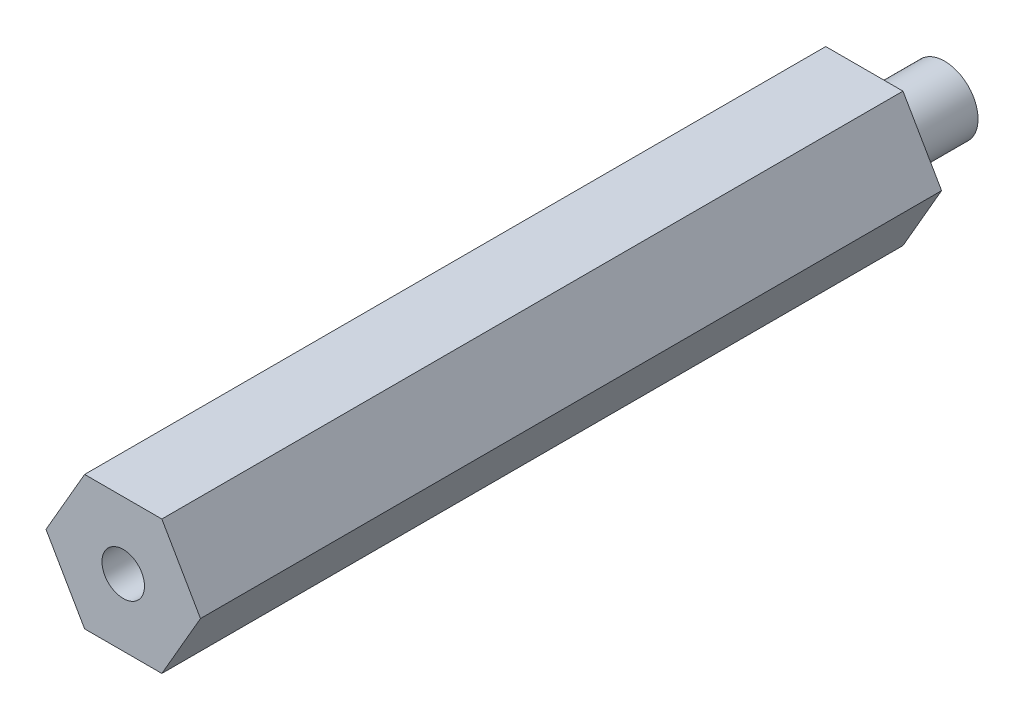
SolidWorks part; units mm, degrees
ref_plane "Front Plane" through (0, 0, 0) normal (0, 0, 1) x (1, 0, 0)
ref_plane "Top Plane" through (0, 0, 0) normal (0, 1, 0) x (1, 0, 0)
ref_plane "Right Plane" through (0, 0, 0) normal (1, 0, 0) x (0, 0, -1)
sketch "Sketch1" plane through (0, 0, 0) normal (0, 0, 1) x (1, 0, 0)
  line L1 (7.3323, 0) -> (3.6662, 6.35)
  line L2 (3.6662, 6.35) -> (-3.6662, 6.35)
  line L3 (-3.6662, 6.35) -> (-7.3323, 0)
  line L4 (-7.3323, 0) -> (-3.6662, -6.35)
  line L5 (-3.6662, -6.35) -> (3.6662, -6.35)
  line L6 (3.6662, -6.35) -> (7.3323, 0)
  circle A0 centre (0, 0) radius 6.35 construction
  dimension "D1" = 12.7
extrude "Boss-Extrude1" add sketch "Sketch1" along normal blind 77.978
sketch "Sketch2" plane through (0, 0, 0) normal (0, 1, 0) x (1, 0, 0)
  line L0 (3.6662, 0) -> (-3.6662, 0) construction
  line L1 (3.175, 0) -> (7.3323, 0)
  line L2 (3.175, 0) -> (3.175, -7.62)
  line L3 (3.175, -7.62) -> (7.3323, -7.62)
  line L4 (7.3323, 0) -> (7.3323, -7.62)
  line L5 (7.3323, -77.978) -> (7.3323, 0) construction
  line L6 (0, 0) -> (0, -77.978) construction
  line L7 (3.6662, -77.978) -> (-3.6662, -77.978) construction
  dimension "D1" = 6.35
  dimension "D3" = 7.62
revolve "Cut-Revolve1" cut sketch "Sketch2" angle 360 about L6
sketch "Sketch3" plane through (0, 0, 77.978) normal (0, 0, 1) x (1, 0, 0)
  line L0 (3.6662, 6.35) -> (-3.6662, -6.35) construction
  line L1 (7.3323, 0) -> (-7.3323, 0) construction
  point P8 (0, 0)
hole_wizard "#10-32 Tapped Hole1" positions "3DSketch2" profile "Sketch5" tap size "#10-32" standard "ANSI Inch"
sketch3d "3DSketch2"
  point P0 (0, 0, 77.978)
sketch "Sketch5" plane through (0, 0, 77.978) normal (1, 0, 0) x (0, -1, 0)
  line L0 (0, 0) -> (0, 13.9133)
  line L1 (0, 13.9133) -> (2.0193, 12.7)
  line L2 (2.0193, 12.7) -> (2.0193, 0)
  line L5 (2.0193, 0) -> (0, 0)
  line L10 (0, 13.9133) -> (-2.0193, 12.7) construction
  line L11 (0, -6.35) -> (0, 107.95) construction
  dimension "Tap Drill Dia." = 4.0386
  dimension "Tap Drill Depth" = 12.7
  dimension "Drill Angle" = 118
